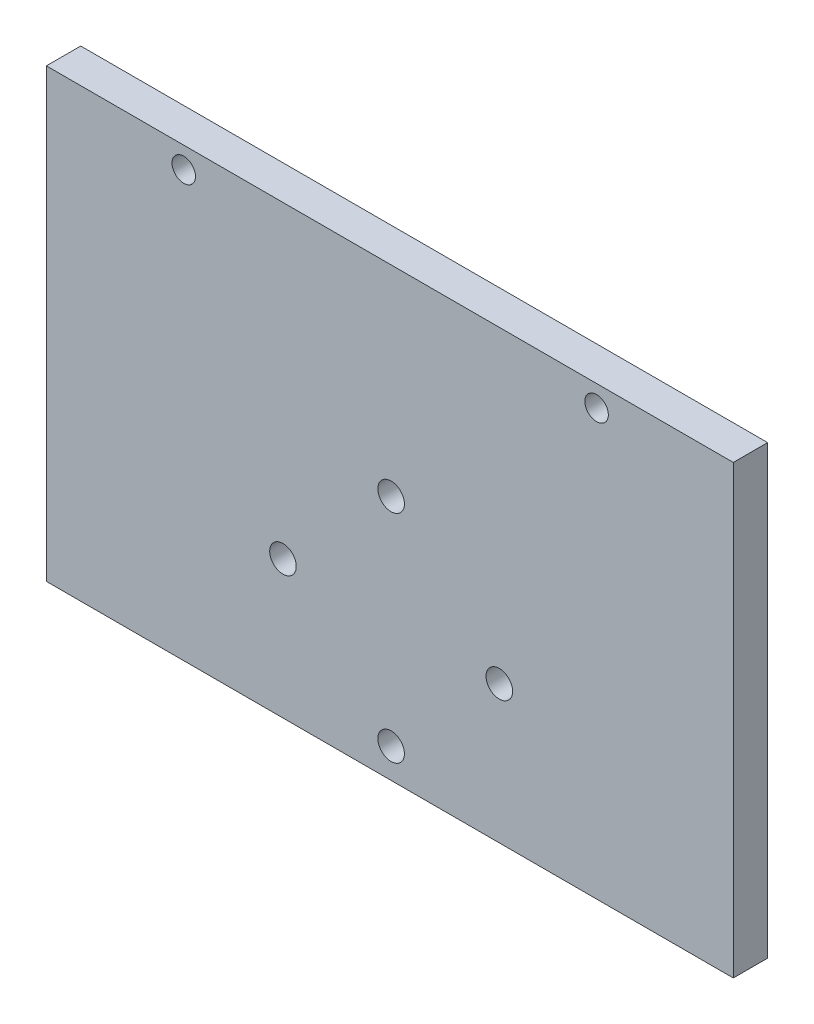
SolidWorks part; units mm, degrees
ref_plane "Front" through (0, 0, 0) normal (0, 0, 1) x (1, 0, 0)
ref_plane "Top" through (0, 0, 0) normal (0, 1, 0) x (1, 0, 0)
ref_plane "Right" through (0, 0, 0) normal (1, 0, 0) x (0, 0, -1)
sketch "Sketch1" plane through (0, 0, 0) normal (0, 0, 1) x (1, 0, 0)
  line L1 (-63.5, -41.275) -> (63.5, -41.275)
  line L2 (-63.5, -41.275) -> (-63.5, 41.275)
  line L3 (-63.5, 41.275) -> (63.5, 41.275)
  line L4 (63.5, -41.275) -> (63.5, 41.275)
  line L5 (-63.5, -41.275) -> (63.5, 41.275) construction
  line L6 (-63.5, 41.275) -> (63.5, -41.275) construction
  point P0 (0, 0)
  dimension "D1" = 127
  dimension "D2" = 82.55
extrude "Boss-Extrude1" add sketch "Sketch1" along normal blind 6.35
hole_wizard "#8 Clearance Hole1" positions "Sketch3" profile "Sketch2" hole size "#8" standard "ANSI Inch"
sketch "Sketch3" plane through (0, 0, 6.35) normal (0, 0, 1) x (1, 0, 0)
  circle A1 centre (0.2432, 4.2111) radius 2.1 construction
  circle A2 centre (0.2432, -35.7889) radius 2.1 construction
  circle A3 centre (-19.7568, -15.7889) radius 2.1 construction
  circle A7 centre (20.2432, -15.7889) radius 2.1 construction
  point P0 (20.2432, -15.7889)
  point P2 (-19.7568, -15.7889)
  point P4 (0.2432, -35.7889)
  point P6 (0.2432, 4.2111)
sketch "Sketch2" plane through (20.2432, -15.7889, 6.35) normal (1, 0, 0) x (0, -1, 0)
  line L0 (0, 0) -> (0, 10.3666)
  line L1 (0, 10.3666) -> (2.4574, 8.89)
  line L2 (2.4574, 8.89) -> (2.4574, 0)
  line L5 (2.4574, 0) -> (0, 0)
  line L10 (0, 10.3666) -> (-2.4574, 8.89) construction
  line L11 (0, -6.35) -> (0, 107.95) construction
  dimension "Hole Dia." = 4.9149
  dimension "Hole Depth" = 8.89
  dimension "Drill Angle" = 118
sketch "Sketch7" plane through (0, 0, 6.35) normal (0, 0, 1) x (1, 0, 0)
  line L0 (-63.5, 37.338) -> (71.6275, 37.338) construction
  line L1 (-63.5, 41.275) -> (-63.5, -41.275) construction
  line L2 (71.6275, 37.338) -> (-63.5, 37.338) construction
  line L3 (-63.5, 37.338) -> (-74.1978, 37.338) construction
  line L4 (63.5, 41.275) -> (-63.5, 41.275) construction
  dimension "D1" = 3.937
sketch "Sketch10" plane through (0, 0, 6.35) normal (0, 0, 1) x (1, 0, 0)
  line L0 (-63.5, 37.338) -> (71.6275, 37.338) construction
  line L1 (-63.5, 41.275) -> (-63.5, -41.275) construction
  line L2 (63.5, -41.275) -> (63.5, 41.275) construction
  circle A0 centre (-38.1, 37.338) radius 2.1717
  circle A1 centre (38.2261, 37.338) radius 2.1717
  dimension "D1" = 25.4
  dimension "D3" = 4.3434
  dimension "D4" = 4.3434
  dimension "D2" = 25.2739
extrude "Cut-Extrude1" cut sketch "Sketch10" against normal blind 6.35
